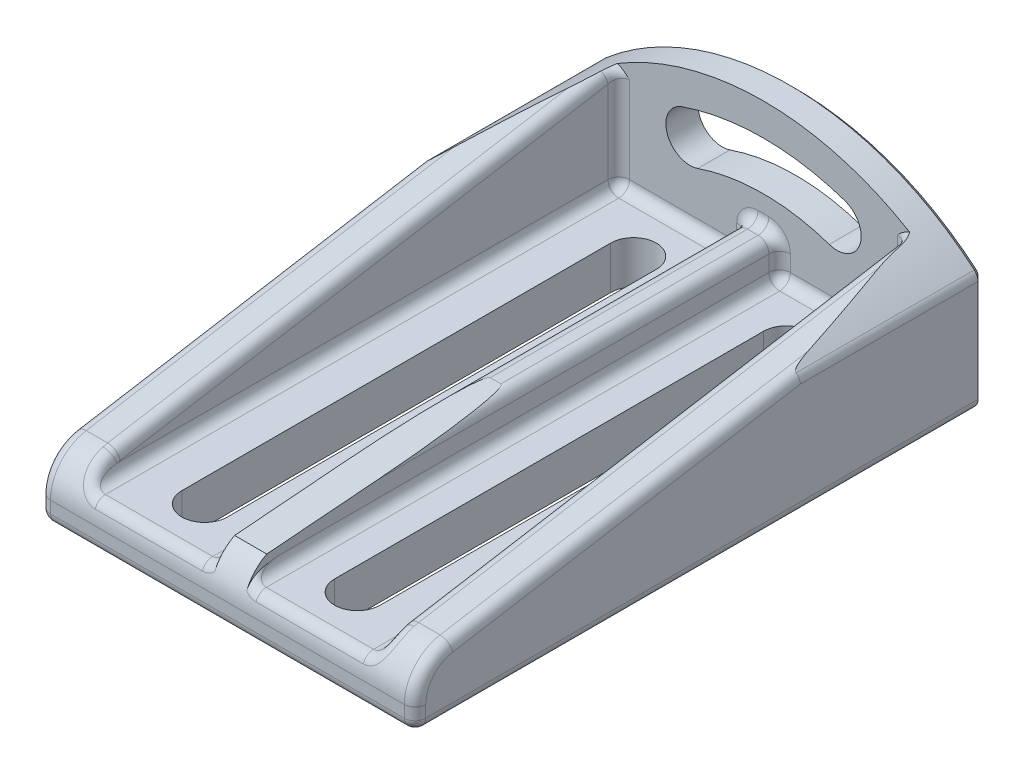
SolidWorks part; units mm, degrees
ref_plane "Front Plane" through (0, 0, 0) normal (0, 0, 1) x (1, 0, 0)
ref_plane "Top Plane" through (0, 0, 0) normal (0, 1, 0) x (1, 0, 0)
ref_plane "Right Plane" through (0, 0, 0) normal (1, 0, 0) x (0, 0, -1)
sketch "Sketch1" plane through (0, 0, 0) normal (0, 0, 1) x (1, 0, 0)
  line L0 (0, 17.6356) -> (0, -17.6356) construction
  line L1 (-19.7944, 0) -> (19.7944, 0) construction
  line L2 (-35, 39.5828) -> (-35, 17.6356)
  line L3 (-35, 17.6356) -> (35, 17.6356)
  line L4 (35, 39.5828) -> (35, 17.6356)
  line L9 (-19.7944, 42.4492) -> (19.7944, -42.4492) construction
  line L10 (19.7944, -42.4492) -> (19.7944, 42.4492) construction
  line L11 (19.7944, 42.4492) -> (-19.7944, -42.4492) construction
  line L12 (-19.7944, -42.4492) -> (-19.7944, 42.4492) construction
  arc A2 (-15.1704, 44.3126) -> (-12.2553, 35.7978) centre (-13.7129, 40.0552) ccw
  arc A3 (12.2553, 35.7978) -> (15.1704, 44.3126) centre (13.7129, 40.0552) ccw
  arc A6 (12.2553, 35.7978) -> (-12.2553, 35.7978) centre (0, 0) ccw
  arc A7 (15.1704, 44.3126) -> (-15.1704, 44.3126) centre (0, 0) ccw
  arc A8 (-35, 39.5828) -> (35, 39.5828) centre (0, 0) cw
  point P4 (0, 0)
  point P14 (0, 52.8375)
  point P25 (75.0907, -23.9026)
  point P30 (0, 46.8375)
  dimension "D4" = 9
  dimension "D5" = 21.9473
  dimension "D1" = 84.8984
  dimension "D2" = 6
  dimension "D3" = 70
  dimension "D6" = 50
extrude "Pivot Extrude" add sketch "Sketch1" along normal blind 6
sketch "Sketch2" plane through (0, 0, 6) normal (0, 0, 1) x (1, 0, 0)
  line L0 (-35, 39.5828) -> (-35, 17.6356)
  line L1 (-35, 17.6356) -> (35, 17.6356)
  line L2 (35, 17.6356) -> (35, 39.5828)
  line L3 (27, 45.4181) -> (27, 25.6356)
  line L4 (27, 25.6356) -> (-27, 25.6356)
  line L5 (-27, 25.6356) -> (-27, 45.4181)
  arc A0 (35, 39.5828) -> (27, 45.4181) centre (0, 0) ccw
  arc A1 (35, 39.5828) -> (-35, 39.5828) centre (0, 0) ccw construction
  arc A2 (-27, 45.4181) -> (-35, 39.5828) centre (0, 0) ccw
  dimension "D1" = 8
  dimension "D2" = 8
  dimension "D3" = 8
extrude "Boss-Extrude1" add sketch "Sketch2" along normal blind 100
sketch "Sketch3" plane through (0, 25.6356, 0) normal (0, 1, 0) x (1, 0, 0)
  line L0 (-18.5, -16) -> (-18.5, -96)
  line L1 (-10, -96) -> (-10, -16)
  line L2 (10, -16) -> (10, -96)
  line L3 (18.5, -96) -> (18.5, -16)
  line L5 (-27, -56) -> (27, -56) construction
  line L6 (-27, -106) -> (-27, -6) construction
  line L7 (27, -106) -> (27, -6) construction
  line L8 (-10, -16) -> (10, -16) construction
  arc A0 (-18.5, -96) -> (-10, -96) centre (-14.25, -96) ccw
  arc A1 (-10, -16) -> (-18.5, -16) centre (-14.25, -16) ccw
  arc A2 (10, -96) -> (18.5, -96) centre (14.25, -96) ccw
  arc A3 (18.5, -16) -> (10, -16) centre (14.25, -16) ccw
  point P13 (0, -16)
  point P19 (-10, -56)
  point P20 (10, -56)
  dimension "D1" = 8.5
  dimension "D2" = 80
  dimension "D3" = 20
extrude "Cut-Extrude1" cut sketch "Sketch3" against normal up to next
sketch "Sketch4" plane through (-35, 0, 0) normal (-1, 0, 0) x (0, 0, 1)
  line L0 (106, 28.6356) -> (6, 45.4181)
  line L1 (106, 39.5828) -> (106, 17.6356) construction
  line L2 (6, 45.4181) -> (106, 45.4181)
  line L3 (106, 45.4181) -> (106, 28.6356)
  line L4 (106, 25.6356) -> (6, 25.6356) construction
  dimension "D1" = 3
extrude "Cut-Extrude2" cut sketch "Sketch4" against normal up to surface (70 mm away)
sketch "Sketch5" plane through (0, 25.6356, 0) normal (0, 1, 0) x (1, 0, 0)
  line L0 (27, -6) -> (-27, -6) construction
  line L1 (-3, -6) -> (3, -6)
  line L2 (-3, -6) -> (-3, -106)
  line L3 (-3, -106) -> (3, -106)
  line L4 (3, -6) -> (3, -106)
  line L5 (27, -106) -> (-27, -106) construction
  line L6 (10, -16) -> (10, -96) construction
  point P8 (0, -6)
  dimension "D1" = 7
extrude "Mid Support" add sketch "Sketch5" along normal blind 7
sketch "Sketch6" plane through (3, 0, 0) normal (1, 0, 0) x (0, 0, -1)
  line L0 (-56, 32.6356) -> (-106, 28.6356)
  line L1 (-106, 32.6356) -> (-6, 32.6356) construction
  line L2 (-106, 32.6356) -> (-106, 25.6356) construction
  line L3 (-106, 28.6356) -> (-106, 32.6356)
  line L4 (-106, 32.6356) -> (-56, 32.6356)
  dimension "D1" = 3
extrude "Mid Support Cut" cut sketch "Sketch6" against normal up to next
fillet "Fillet1" radius 2 13 edges at (15, 25.6356, 6) (-15, 25.6356, 6) (27, 25.6356, 56) (-27, 25.6356, 56) (3, 32.6356, 31) (-3, 32.6356, 31) (3, 25.6356, 56) (-3, 25.6356, 56) (3, 29.1356, 6) (0, 32.6356, 6) (-3, 29.1356, 6)
fillet "Fillet2" radius 8 1 edges at (-31, 28.6356, 106)
fillet "Fillet3" radius 2 23 edges at (-35, 19.7509, 106) (-35, 27.0338, 104.1071) (35, 19.7509, 106) (35, 27.0338, 104.1071) (-26.4142, 45.3198, 6.5858) (-27, 29.014, 101.5931) (-26.5233, 26.3396, 104.6325) (15, 25.6356, 105.0564) (-15, 25.6356, 105.0564) (26.1229, 25.9805, 104.861) (27, 29.014, 101.5931) (26.4142, 45.3198, 6.5858) (-35, 39.5828, 20.3849) (-35, 34.6694, 70.0469) (35, 39.5828, 20.3849) (35, 34.6694, 70.0469) (0, 17.6356, 106) (35, 17.6356, 53) (-35, 17.6356, 53) (3.4767, 26.3396, 104.6325) (-3.8771, 25.9805, 104.861)
chamfer "Chamfer1" distance 1 angle 45 8 edges at (0, 52.8375, 0) (-34.8161, 39.5088, 0) (34.8161, 39.5088, 0) (-35, 29.1533, 0) (35, 29.1533, 0) (-34.4142, 18.2213, 0) (34.4142, 18.2213, 0) (0, 17.6356, 0)
